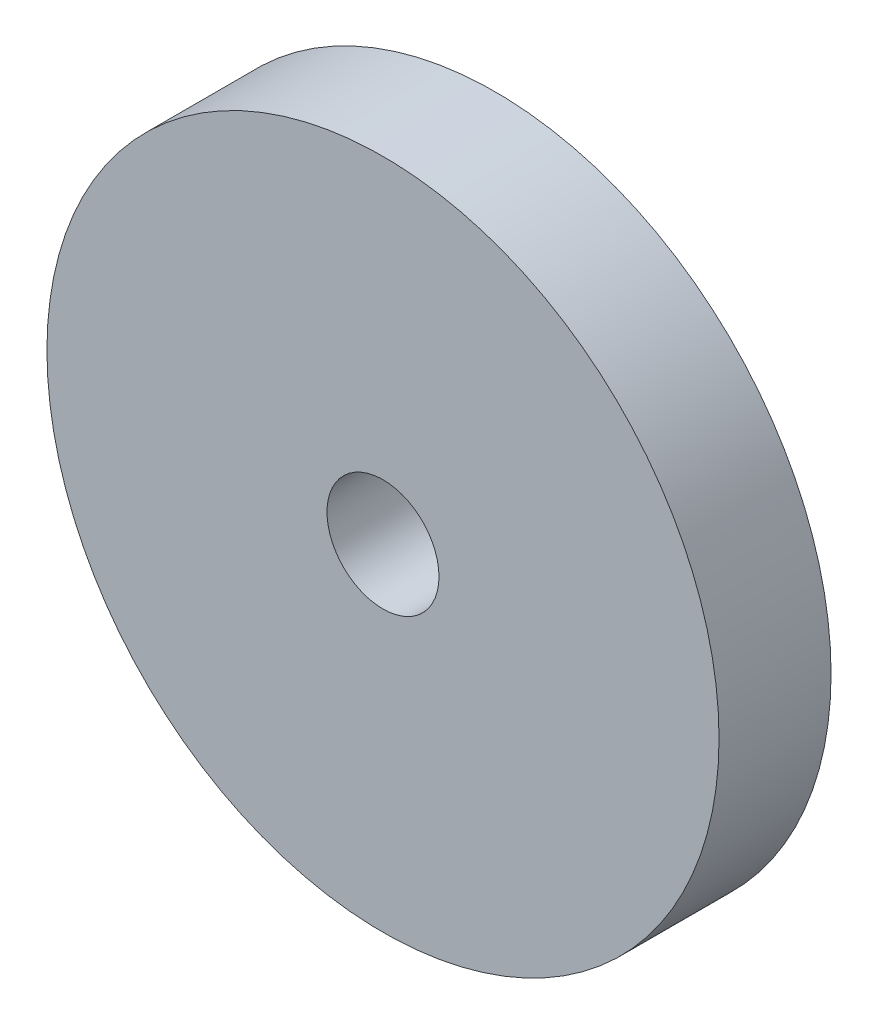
SolidWorks part; units mm, degrees
ref_plane "Front Plane" through (0, 0, 0) normal (0, 0, 1) x (1, 0, 0)
ref_plane "Top Plane" through (0, 0, 0) normal (0, 1, 0) x (1, 0, 0)
ref_plane "Right Plane" through (0, 0, 0) normal (1, 0, 0) x (0, 0, -1)
sketch "Sketch1" plane through (0, 0, 0) normal (0, 0, 1) x (1, 0, 0)
  circle A0 centre (0, 0) radius 19.05
  circle A1 centre (0, 0) radius 3.175
  dimension "D1" = 38.1
  dimension "D2" = 6.35
extrude "Boss-Extrude1" add sketch "Sketch1" along normal blind 6.35
